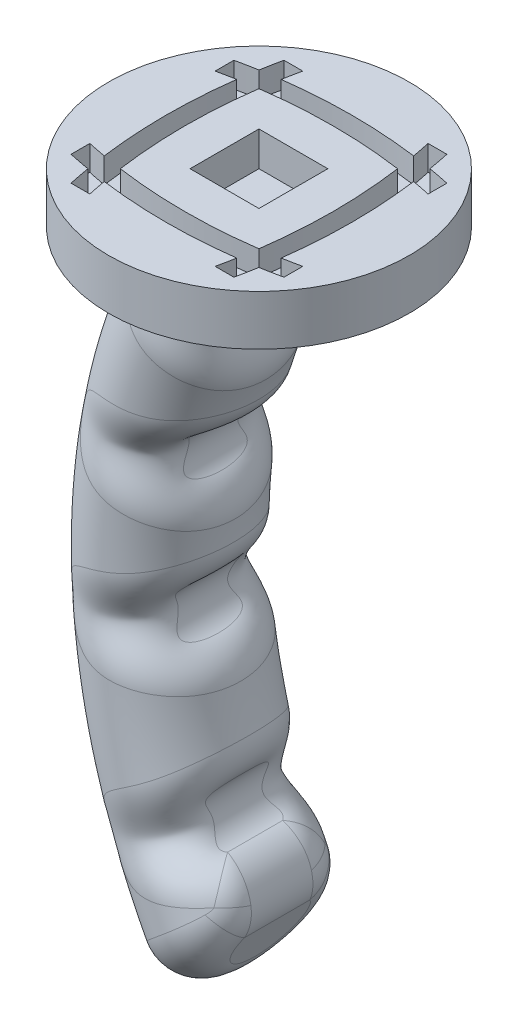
SolidWorks part; units mm, degrees
ref_plane "Front Plane" through (0, 0, 0) normal (0, 0, 1) x (1, 0, 0)
ref_plane "Top Plane" through (0, 0, 0) normal (0, 1, 0) x (1, 0, 0)
ref_plane "Right Plane" through (0, 0, 0) normal (1, 0, 0) x (0, 0, -1)
sketch "Sketch1" plane through (0, 0, 0) normal (0, 1, 0) x (1, 0, 0)
  circle A0 centre (0, 0) radius 24
  dimension "D1" = 48
extrude "Boss-Extrude1" add sketch "Sketch1" along normal blind 8
sketch "Sketch3" plane through (0, 8, 0) normal (0, 1, 0) x (1, 0, 0)
  line L0 (-5.5, 5.5) -> (5.5, 5.5)
  line L1 (5.5, 5.5) -> (5.5, -5.5)
  line L2 (5.5, -5.5) -> (-5.5, -5.5)
  line L3 (-5.5, -5.5) -> (-5.5, 5.5)
  dimension "D1" = 11
  dimension "D2" = 5.5
  dimension "D3" = 11
  dimension "D4" = 5.5
extrude "Cut-Extrude2" cut sketch "Sketch3" against normal blind 5.5
ref_plane "Plane1" through (0, -30, 0) normal (0, -1, 0) x (-1, 0, 0)
ref_plane "Plane2" through (0, -100, 0) normal (0, -1, 0) x (-1, 0, 0)
sketch "Sketch5" plane through (0, 0, 0) normal (0, -1, 0) x (1, 0, 0)
  circle A0 centre (0, 0) radius 12
  dimension "D1" = 24
sketch "Sketch6" plane through (0, -30, 0) normal (0, -1, 0) x (-1, 0, 0)
  circle A0 centre (12, 0) radius 12
  dimension "D1" = 24
  dimension "D2" = 12
sketch "Sketch7" plane through (0, -100, 0) normal (0, -1, 0) x (-1, 0, 0)
  circle A0 centre (0, 0) radius 12
sketch "Sketch8" plane through (0, 0, 0) normal (0, 0, 1) x (1, 0, 0)
  line L2 (-24, 0) -> (24, 0) construction
  line L3 (-12, -100) -> (12, -100) construction
  arc A0 (0, 0) -> (0, -100) centre (81.575, -50) ccw
sweep "Sweep1" add profiles "Sketch5" path "Sketch8"
fillet "Fillet4" radius 6 1 edges at (0, -100, -12)
sketch "Sketch16" [suppressed] plane through (0, 0, 0) normal (0, 0, 1) x (1, 0, 0)
  line L0 (-0.6307, -101.2383) -> (4.0791, -91.9905)
  line L1 (-12, 0) -> (12, 0)
  arc A0 (-11.2253, -101.4235) -> (-0.6307, -101.2383) centre (-5.9772, -98.5154) ccw
sketch "Sketch17" plane through (0, 0, 0) normal (0, 0, 1) x (1, 0, 0)
  line L0 (4.7852, -7.4094) -> (4.7852, -21.8377)
  line L1 (-5.4458, -110.6931) -> (5.4458, -89.3069) construction
  line L2 (-11.2253, -101.4235) -> (4.1543, -86.6976)
  line L3 (-12, 0) -> (12, 0)
  line L4 (-68.9761, -80) -> (77.5035, -80)
  line L5 (-2.3993, -28.4508) -> (-2.3993, -40.1729)
  line L6 (90.4641, -100) -> (-70.9324, -100)
  line L7 (65.2765, -55) -> (-77.7796, -55)
  line L8 (1.3211, -69.7141) -> (1.3211, -91.427)
  line L9 (63.5647, -33) -> (-83.8931, -33)
  line L10 (-3.9568, -66.0159) -> (-3.9568, -41.9035)
  line L11 (70.1673, -12) -> (-77.7796, -12)
  arc A2 (0, 0) -> (0, -100) centre (81.575, -50) ccw
  arc A3 (12, 0) -> (4.1543, -86.6976) centre (81.575, -50) ccw construction
  arc A4 (4.1543, -86.6976) -> (12, 0) centre (81.575, -50) cw
  arc A5 (-12, 0) -> (-11.2253, -101.4235) centre (81.575, -50) ccw
  arc A6 (-12, 0) -> (-11.2253, -101.4235) centre (81.575, -50) ccw construction
  point P4 (4.7852, -12)
  point P35 (-2.3993, -33)
  point P38 (-3.9568, -55)
  point P39 (1.3211, -80)
  dimension "D1" = 0
  dimension "D2" = 0
  dimension "D3" = 0
  dimension "D4" = 12
  dimension "D5" = 33
  dimension "D6" = 55
  dimension "D7" = 80
ref_plane "Plane3" through (1.3211, 0, 0) normal (1, 0, 0) x (0, 0, -1)
ref_plane "Plane4" through (-3.9568, 0, 0) normal (1, 0, 0) x (0, 0, -1)
ref_plane "Plane5" through (-2.3993, 0, 0) normal (1, 0, 0) x (0, 0, -1)
ref_plane "Plane6" through (4.7852, 0, 0) normal (1, 0, 0) x (0, 0, -1)
sketch "Sketch18" plane through (1.3211, 0, 0) normal (1, 0, 0) x (0, 0, -1)
  line L0 (-12, -80) -> (12, -80)
  line L1 (-12, 0) -> (-12, -93.7162) construction
  line L2 (12, -93.7162) -> (12, 0) construction
  line L3 (12, -80) -> (12, -85)
  line L4 (12, -93.7162) -> (12, 0) construction
  line L5 (12, -85) -> (-12, -85)
  line L6 (-12, 0) -> (-12, -93.7162) construction
  line L7 (-12, -85) -> (-12, -80)
  dimension "D1" = 5
  dimension "D2" = 0
revolve "Cut-Revolve3" cut sketch "Sketch18" angle 360 about L0
sketch "Sketch19" plane through (-3.9568, 0, 0) normal (1, 0, 0) x (0, 0, -1)
  line L1 (-12, -55) -> (11.9282, -55)
  line L2 (-12, 0) -> (-12, -93.7162) construction
  line L3 (11.9282, -55) -> (11.9282, -60)
  line L4 (11.9282, -60) -> (-12, -60)
  line L5 (-12, -60) -> (-12, -55)
  dimension "D1" = 5
revolve "Cut-Revolve4" cut sketch "Sketch19" angle 360 about L1
sketch "Sketch20" plane through (-2.3993, 0, 0) normal (1, 0, 0) x (0, 0, -1)
  line L0 (-12, -33) -> (12, -33)
  line L1 (12, -93.7162) -> (12, 0) construction
  line L3 (12, -33) -> (12, -38)
  line L5 (-12, 0) -> (-12, -93.7162) construction
  line L7 (12, -38) -> (-12, -38)
  line L8 (-12, -38) -> (-12, -33)
  dimension "D1" = 5
revolve "Cut-Revolve5" cut sketch "Sketch20" angle 360 about L0
sketch "Sketch21" plane through (4.7852, 0, 0) normal (1, 0, 0) x (0, 0, -1)
  line L4 (-12, -12) -> (12, -12)
  line L5 (12, -12) -> (12, -17)
  line L6 (12, -17) -> (-12, -17)
  line L7 (-12, -17) -> (-12, -12)
  dimension "D1" = 24
  dimension "D3" = 5
revolve "Cut-Revolve6" cut sketch "Sketch21" angle 360 about L4
fillet "Fillet7" radius 7 4 edges at (1.3185, -8.3969, 10.2361) (-6.2354, -29.7931, 10.012) (-7.1375, -51.1422, 8.6796) (-3.5303, -78.7902, 9.7962)
sketch "Sketch22" plane through (0, 8, 0) normal (0, 1, 0) x (1, 0, 0)
  line L0 (-17, 13) -> (-17, 10)
  line L1 (17, 13) -> (17, 10)
  line L2 (13, 17) -> (10, 17)
  line L3 (13, -17) -> (10, -17)
  line L4 (17, -13) -> (17, -10)
  line L5 (-17, -13) -> (-17, -10)
  line L6 (-13, -17) -> (-10, -17)
  line L7 (-13, 17) -> (-10, 17)
  arc A0 (-17, 13) -> (-13.6534, 13.6534) centre (0, -65.1729) cw
  arc A1 (-17, 10) -> (-14.125, 10.5759) centre (0, -67.4052) cw
  arc A2 (13, 17) -> (13.6534, 13.6534) centre (-65.1729, 0) cw
  arc A3 (10, 17) -> (10.5759, 14.125) centre (-67.4052, 0) cw
  arc A4 (17, -13) -> (13.6534, -13.6534) centre (0, 65.1729) cw
  arc A5 (17, -10) -> (14.125, -10.5759) centre (0, 67.4052) cw
  arc A6 (-13, -17) -> (-13.6534, -13.6534) centre (65.1729, 0) cw
  arc A7 (-10, -17) -> (-10.5759, -14.125) centre (67.4052, 0) cw
  arc A8 (-10.5759, 14.125) -> (10.5759, 14.125) centre (0, -65.1729) cw
  arc A9 (-13.6534, 13.6534) -> (-13, 17) centre (65.1729, 0) cw
  arc A10 (-10.5759, 14.125) -> (-10, 17) centre (67.4052, 0) cw
  arc A11 (-11.0681, 11.0681) -> (11.0681, 11.0681) centre (0, -67.4052) cw
  arc A12 (13.6534, 13.6534) -> (17, 13) centre (0, -65.1729) cw
  arc A13 (14.125, 10.5759) -> (17, 10) centre (0, -67.4052) cw
  arc A14 (11.0681, 11.0681) -> (11.0681, -11.0681) centre (-67.4052, 0) cw
  arc A15 (14.125, 10.5759) -> (14.125, -10.5759) centre (-65.1729, 0) cw
  arc A16 (11.0681, -11.0681) -> (-11.0681, -11.0681) centre (0, 67.4052) cw
  arc A17 (10.5759, -14.125) -> (-10.5759, -14.125) centre (0, 65.1729) cw
  arc A18 (13.6534, -13.6534) -> (13, -17) centre (-65.1729, 0) cw
  arc A19 (10.5759, -14.125) -> (10, -17) centre (-67.4052, 0) cw
  arc A20 (-14.125, -10.5759) -> (-17, -10) centre (0, 67.4052) cw
  arc A21 (-13.6534, -13.6534) -> (-17, -13) centre (0, 65.1729) cw
  arc A22 (-14.125, -10.5759) -> (-14.125, 10.5759) centre (65.1729, 0) cw
  arc A23 (-11.0681, -11.0681) -> (-11.0681, 11.0681) centre (67.4052, 0) cw
  point P27 (0, 0)
  dimension "D7" = 80
  dimension "D8" = 79.25
  dimension "D1" = 3
  dimension "D2" = 3
  dimension "D3" = 10
  dimension "D4" = 10
  dimension "D5" = 34
  dimension "D6" = 17
  dimension "D9" = 4
extrude "Cut-Extrude3" cut sketch "Sketch22" against normal blind 4
